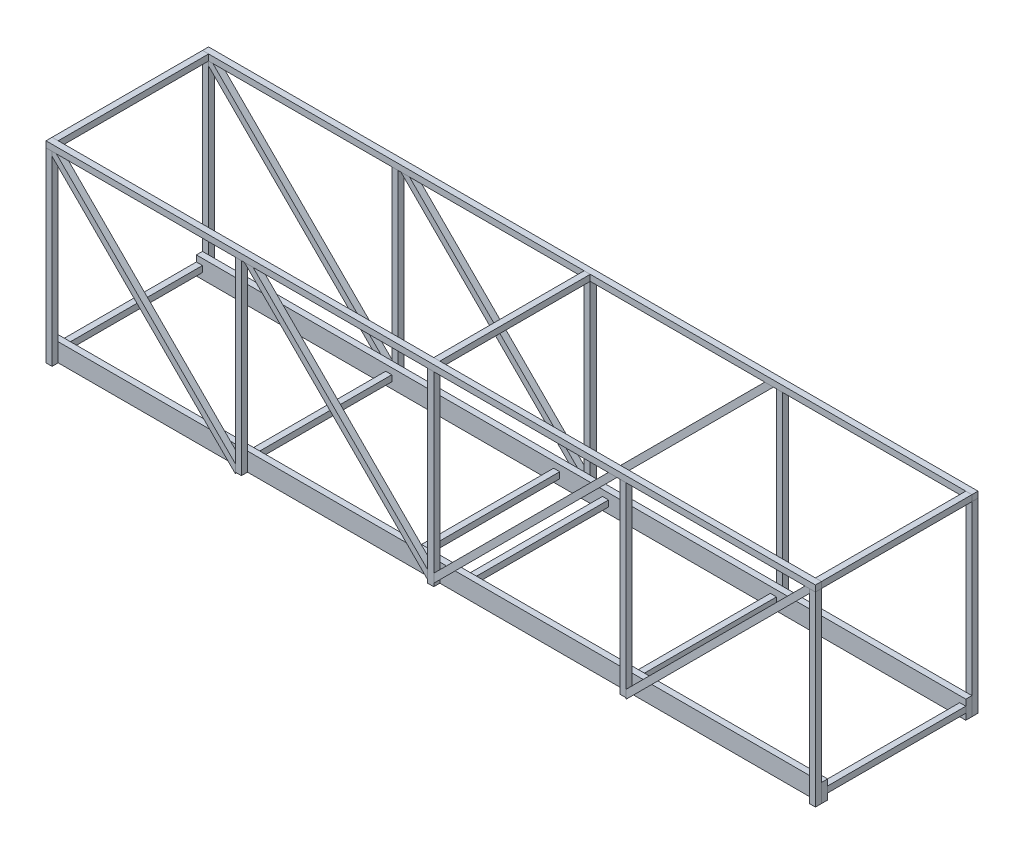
SolidWorks part; units mm, degrees
ref_plane "Front Plane" through (0, 0, 0) normal (0, 0, 1) x (1, 0, 0)
ref_plane "Top Plane" through (0, 0, 0) normal (0, 1, 0) x (1, 0, 0)
ref_plane "Right Plane" through (0, 0, 0) normal (1, 0, 0) x (0, 0, -1)
sketch "Sketch1" plane through (0, 0, 0) normal (0, 1, 0) x (1, 0, 0)
  line L0 (0, 37.5) -> (0, -37.5) construction
  line L1 (-200, -37.5) -> (200, -37.5)
  line L2 (-200, -37.5) -> (-200, 37.5)
  line L3 (-200, 37.5) -> (200, 37.5)
  line L4 (200, -37.5) -> (200, 37.5)
  line L5 (-200, -37.5) -> (200, 37.5) construction
  line L6 (-200, 37.5) -> (200, -37.5) construction
  line L7 (-100, 37.5) -> (-100, -37.5)
  line L8 (-12.7, -37.5) -> (-12.7, 37.5)
  line L9 (12.7, 37.5) -> (12.7, -37.5)
  line L10 (100, 37.5) -> (100, -37.5)
  point P0 (0, 0)
  dimension "D1" = 400
  dimension "D2" = 75
  dimension "D3" = 25.4
  dimension "D4" = 100
  dimension "D5" = 100
other "Structural Member1"
ref_plane "Plane1" through (-200, 0, 37.5) normal (1, 0, 0) x (0, 0, -1)
sketch "Sketch12" plane through (-200, 0, 37.5) normal (1, 0, 0) x (0, 0, -1)
  line L1 (-1.5875, -4.7625) -> (1.5875, -4.7625)
  line L2 (-1.5875, -4.7625) -> (-1.5875, 4.7625)
  line L3 (-1.5875, 4.7625) -> (1.5875, 4.7625)
  line L4 (1.5875, -4.7625) -> (1.5875, 4.7625)
  line L5 (-1.5875, -4.7625) -> (1.5875, 4.7625) construction
  line L6 (-1.5875, 4.7625) -> (1.5875, -4.7625) construction
  point P0 (0, 0)
  point P5 (0, 4.7625)
  point P6 (1.5875, 0)
  point P7 (0, -4.7625)
  point P8 (-1.5875, 0)
  point P9 (0, 0)
  dimension "D1" = 3.175
  dimension "D2" = 9.525
other "Structural Member2"
ref_plane "Plane2" through (200, 0, 37.5) normal (0, 0, -1) x (-1, 0, 0)
sketch "Sketch14" plane through (198.4125, 0, 37.5) normal (0, 0, -1) x (-1, 0, 0)
  line L1 (-1.5875, -1.5875) -> (1.5875, -1.5875)
  line L2 (-1.5875, -1.5875) -> (-1.5875, 1.5875)
  line L3 (-1.5875, 1.5875) -> (1.5875, 1.5875)
  line L4 (1.5875, -1.5875) -> (1.5875, 1.5875)
  line L5 (-1.5875, -1.5875) -> (1.5875, 1.5875) construction
  line L6 (-1.5875, 1.5875) -> (1.5875, -1.5875) construction
  point P0 (0, 0)
  point P5 (-1.5875, 0)
  point P6 (0, 1.5875)
  point P7 (1.5875, 0)
  point P8 (0, -1.5875)
  point P9 (0, 0)
  dimension "D1" = 3.175
other "Structural Member3"
ref_plane "Plane3" through (-200, 0, 37.5) normal (0, 0, -1) x (-1, 0, 0)
sketch "Sketch15" plane through (-198.4125, 0, 37.5) normal (0, 0, -1) x (-1, 0, 0)
  line L1 (-1.5875, -1.5875) -> (1.5875, -1.5875)
  line L2 (-1.5875, -1.5875) -> (-1.5875, 1.5875)
  line L3 (-1.5875, 1.5875) -> (1.5875, 1.5875)
  line L4 (1.5875, -1.5875) -> (1.5875, 1.5875)
  line L5 (-1.5875, -1.5875) -> (1.5875, 1.5875) construction
  line L6 (-1.5875, 1.5875) -> (1.5875, -1.5875) construction
  point P0 (0, 0)
  point P5 (-1.5875, 0)
  point P6 (0, 1.5875)
  point P7 (1.5875, 0)
  point P8 (0, -1.5875)
  point P9 (0, 0)
  dimension "D1" = 3.175
other "Structural Member4"
ref_plane "Plane4" through (-100, 0, -37.5) normal (0, 0, 1) x (1, 0, 0)
sketch "Sketch16" plane through (-100, 0, -37.5) normal (0, 0, 1) x (1, 0, 0)
  line L1 (-1.5875, -1.5875) -> (1.5875, -1.5875)
  line L2 (-1.5875, -1.5875) -> (-1.5875, 1.5875)
  line L3 (-1.5875, 1.5875) -> (1.5875, 1.5875)
  line L4 (1.5875, -1.5875) -> (1.5875, 1.5875)
  line L5 (-1.5875, -1.5875) -> (1.5875, 1.5875) construction
  line L6 (-1.5875, 1.5875) -> (1.5875, -1.5875) construction
  point P0 (0, 0)
  point P5 (-1.5875, 0)
  point P6 (0, 1.5875)
  point P7 (1.5875, 0)
  point P8 (0, -1.5875)
  point P9 (0, 0)
  dimension "D1" = 3.175
other "Trim/Extend1"
sketch "Sketch18" plane through (0, 0, 39.0875) normal (0, 0, 1) x (1, 0, 0)
  line L0 (-200, -4.7625) -> (-200, 95.2375)
  line L1 (-200, 95.2375) -> (200, 95.2375)
  line L2 (200, -4.7625) -> (200, 95.2375)
  line L3 (0, -4.7625) -> (0, 95.2375)
  line L4 (200, -4.7625) -> (-200, -4.7625) construction
  line L5 (-100, 95.2375) -> (-100, -4.7625)
  line L6 (100, 95.2375) -> (100, -4.7625)
  dimension "D1" = 100
  dimension "D2" = 100
  dimension "D3" = 100
other "Structural Member5"
ref_plane "Plane5" through (-200, -4.7625, 39.0875) normal (0, 1, 0) x (-1, 0, 0)
sketch "Sketch17" plane through (-198.4125, -4.7625, 40.675) normal (0, 1, 0) x (-1, 0, 0)
  line L1 (-1.5875, -1.5875) -> (1.5875, -1.5875)
  line L2 (-1.5875, -1.5875) -> (-1.5875, 1.5875)
  line L3 (-1.5875, 1.5875) -> (1.5875, 1.5875)
  line L4 (1.5875, -1.5875) -> (1.5875, 1.5875)
  line L5 (-1.5875, -1.5875) -> (1.5875, 1.5875) construction
  line L6 (-1.5875, 1.5875) -> (1.5875, -1.5875) construction
  point P0 (0, 0)
  point P5 (-1.5875, 0)
  point P6 (0, 1.5875)
  point P7 (1.5875, 0)
  point P8 (0, -1.5875)
  point P9 (0, 0)
  dimension "D1" = 3.175
other "Structural Member6"
ref_plane "Plane6" through (200, -4.7625, 39.0875) normal (0, 1, 0) x (-1, 0, 0)
sketch "Sketch19" plane through (198.4125, -4.7625, 40.675) normal (0, 1, 0) x (-1, 0, 0)
  line L1 (-1.5875, -1.5875) -> (1.5875, -1.5875)
  line L2 (-1.5875, -1.5875) -> (-1.5875, 1.5875)
  line L3 (-1.5875, 1.5875) -> (1.5875, 1.5875)
  line L4 (1.5875, -1.5875) -> (1.5875, 1.5875)
  line L5 (-1.5875, -1.5875) -> (1.5875, 1.5875) construction
  line L6 (-1.5875, 1.5875) -> (1.5875, -1.5875) construction
  point P0 (0, 0)
  point P5 (-1.5875, 0)
  point P6 (0, 1.5875)
  point P7 (1.5875, 0)
  point P8 (0, -1.5875)
  point P9 (0, 0)
  dimension "D1" = 3.175
other "Structural Member7"
ref_plane "Plane7" through (100, 95.2375, 39.0875) normal (0, -1, 0) x (1, 0, 0)
sketch "Sketch110" plane through (100, 95.2375, 40.675) normal (0, -1, 0) x (1, 0, 0)
  line L1 (-1.5875, -1.5875) -> (1.5875, -1.5875)
  line L2 (-1.5875, -1.5875) -> (-1.5875, 1.5875)
  line L3 (-1.5875, 1.5875) -> (1.5875, 1.5875)
  line L4 (1.5875, -1.5875) -> (1.5875, 1.5875)
  line L5 (-1.5875, -1.5875) -> (1.5875, 1.5875) construction
  line L6 (-1.5875, 1.5875) -> (1.5875, -1.5875) construction
  point P0 (0, 0)
  point P5 (-1.5875, 0)
  point P6 (0, 1.5875)
  point P7 (1.5875, 0)
  point P8 (0, -1.5875)
  point P9 (0, 0)
  dimension "D1" = 3.175
other "Structural Member8"
ref_plane "Plane8" through (-200, 95.2375, 39.0875) normal (1, 0, 0) x (0, 1, 0)
sketch "Sketch111" plane through (-200, 93.65, 40.675) normal (1, 0, 0) x (0, 1, 0)
  line L1 (-1.5875, -1.5875) -> (1.5875, -1.5875)
  line L2 (-1.5875, -1.5875) -> (-1.5875, 1.5875)
  line L3 (-1.5875, 1.5875) -> (1.5875, 1.5875)
  line L4 (1.5875, -1.5875) -> (1.5875, 1.5875)
  line L5 (-1.5875, -1.5875) -> (1.5875, 1.5875) construction
  line L6 (-1.5875, 1.5875) -> (1.5875, -1.5875) construction
  point P0 (0, 0)
  point P5 (-1.5875, 0)
  point P6 (0, 1.5875)
  point P7 (1.5875, 0)
  point P8 (0, -1.5875)
  point P9 (0, 0)
  dimension "D1" = 3.175
other "Trim/Extend2"
sketch "Sketch124" plane through (0, 0, -39.0875) normal (0, 0, -1) x (-1, 0, 0)
  line L0 (-200, -4.7625) -> (-200, 95.2375)
  line L1 (200, -4.7625) -> (200, 95.2375)
  line L2 (0, -4.7625) -> (0, 95.2375)
  line L3 (-200, -4.7625) -> (200, -4.7625) construction
  line L4 (-100, -4.7625) -> (-100, 95.2375)
  line L5 (100, -4.7625) -> (100, 95.2375)
  line L6 (200, 95.2375) -> (-200, 95.2375)
  line L7 (200, 95.2375) -> (-200, 95.2375) construction
  line L8 (-100, 95.2375) -> (-100, -4.7625) construction
  line L9 (100, 95.2375) -> (100, -4.7625) construction
other "Structural Member15"
ref_plane "Plane16" through (200, -4.7625, -39.0875) normal (0, 1, 0) x (1, 0, 0)
sketch "Sketch125" plane through (198.4125, -4.7625, -40.675) normal (0, 1, 0) x (1, 0, 0)
  line L1 (-1.5875, -1.5875) -> (1.5875, -1.5875)
  line L2 (-1.5875, -1.5875) -> (-1.5875, 1.5875)
  line L3 (-1.5875, 1.5875) -> (1.5875, 1.5875)
  line L4 (1.5875, -1.5875) -> (1.5875, 1.5875)
  line L5 (-1.5875, -1.5875) -> (1.5875, 1.5875) construction
  line L6 (-1.5875, 1.5875) -> (1.5875, -1.5875) construction
  point P0 (0, 0)
  point P5 (-1.5875, 0)
  point P6 (0, 1.5875)
  point P7 (1.5875, 0)
  point P8 (0, -1.5875)
  point P9 (0, 0)
  dimension "D1" = 3.175
other "Structural Member16"
ref_plane "Plane17" through (-200, -4.7625, -39.0875) normal (0, 1, 0) x (1, 0, 0)
sketch "Sketch126" plane through (-198.4125, -4.7625, -40.675) normal (0, 1, 0) x (1, 0, 0)
  line L1 (-1.5875, -1.5875) -> (1.5875, -1.5875)
  line L2 (-1.5875, -1.5875) -> (-1.5875, 1.5875)
  line L3 (-1.5875, 1.5875) -> (1.5875, 1.5875)
  line L4 (1.5875, -1.5875) -> (1.5875, 1.5875)
  line L5 (-1.5875, -1.5875) -> (1.5875, 1.5875) construction
  line L6 (-1.5875, 1.5875) -> (1.5875, -1.5875) construction
  point P0 (0, 0)
  point P5 (-1.5875, 0)
  point P6 (0, 1.5875)
  point P7 (1.5875, 0)
  point P8 (0, -1.5875)
  point P9 (0, 0)
  dimension "D1" = 3.175
other "Structural Member17"
ref_plane "Plane18" through (100, -4.7625, -39.0875) normal (0, 1, 0) x (1, 0, 0)
sketch "Sketch127" plane through (100, -4.7625, -40.675) normal (0, 1, 0) x (1, 0, 0)
  line L1 (-1.5875, -1.5875) -> (1.5875, -1.5875)
  line L2 (-1.5875, -1.5875) -> (-1.5875, 1.5875)
  line L3 (-1.5875, 1.5875) -> (1.5875, 1.5875)
  line L4 (1.5875, -1.5875) -> (1.5875, 1.5875)
  line L5 (-1.5875, -1.5875) -> (1.5875, 1.5875) construction
  line L6 (-1.5875, 1.5875) -> (1.5875, -1.5875) construction
  point P0 (0, 0)
  point P5 (-1.5875, 0)
  point P6 (0, 1.5875)
  point P7 (1.5875, 0)
  point P8 (0, -1.5875)
  point P9 (0, 0)
  dimension "D1" = 3.175
other "Structural Member18"
ref_plane "Plane19" through (-200, 95.2375, -39.0875) normal (1, 0, 0) x (0, -1, 0)
sketch "Sketch128" plane through (-200, 93.65, -40.675) normal (1, 0, 0) x (0, -1, 0)
  line L1 (-1.5875, -1.5875) -> (1.5875, -1.5875)
  line L2 (-1.5875, -1.5875) -> (-1.5875, 1.5875)
  line L3 (-1.5875, 1.5875) -> (1.5875, 1.5875)
  line L4 (1.5875, -1.5875) -> (1.5875, 1.5875)
  line L5 (-1.5875, -1.5875) -> (1.5875, 1.5875) construction
  line L6 (-1.5875, 1.5875) -> (1.5875, -1.5875) construction
  point P0 (0, 0)
  point P5 (-1.5875, 0)
  point P6 (0, 1.5875)
  point P7 (1.5875, 0)
  point P8 (0, -1.5875)
  point P9 (0, 0)
  dimension "D1" = 3.175
other "Trim/Extend3"
sketch "Sketch112" plane through (0, 0, 39.0875) normal (0, 0, 1) x (1, 0, 0)
  line L0 (0, -4.7625) -> (100, 95.2375)
  line L1 (200, -4.7625) -> (-200, -4.7625) construction
  line L3 (-100, 95.2375) -> (0, -4.7625)
other "Structural Member9"
ref_plane "Plane9" through (0, -4.7625, 39.0875) normal (0.7071, 0.7071, 0) x (-0.7071, 0.7071, 0)
sketch "Sketch113" plane through (-1.1225, -3.64, 40.675) normal (0.7071, 0.7071, 0) x (-0.7071, 0.7071, 0)
  line L1 (-1.5875, -1.5875) -> (1.5875, -1.5875)
  line L2 (-1.5875, -1.5875) -> (-1.5875, 1.5875)
  line L3 (-1.5875, 1.5875) -> (1.5875, 1.5875)
  line L4 (1.5875, -1.5875) -> (1.5875, 1.5875)
  line L5 (-1.5875, -1.5875) -> (1.5875, 1.5875) construction
  line L6 (-1.5875, 1.5875) -> (1.5875, -1.5875) construction
  point P0 (0, 0)
  point P5 (-1.5875, 0)
  point P6 (0, 1.5875)
  point P7 (1.5875, 0)
  point P8 (0, -1.5875)
  point P9 (0, 0)
  dimension "D1" = 3.175
other "Trim/Extend6"
sketch "Sketch129" plane through (0, 0, -39.0875) normal (0, 0, -1) x (-1, 0, 0)
  line L0 (0, -4.7625) -> (100, 95.2375)
  line L1 (0, -4.7625) -> (-100, 95.2375)
other "Structural Member19"
ref_plane "Plane20" through (0, -4.7625, -39.0875) normal (0.7071, 0.7071, 0) x (0.7071, -0.7071, 0)
sketch "Sketch130" plane through (-1.1225, -3.64, -40.675) normal (0.7071, 0.7071, 0) x (0.7071, -0.7071, 0)
  line L1 (-1.5875, -1.5875) -> (1.5875, -1.5875)
  line L2 (-1.5875, -1.5875) -> (-1.5875, 1.5875)
  line L3 (-1.5875, 1.5875) -> (1.5875, 1.5875)
  line L4 (1.5875, -1.5875) -> (1.5875, 1.5875)
  line L5 (-1.5875, -1.5875) -> (1.5875, 1.5875) construction
  line L6 (-1.5875, 1.5875) -> (1.5875, -1.5875) construction
  point P0 (0, 0)
  point P5 (-1.5875, 0)
  point P6 (0, 1.5875)
  point P7 (1.5875, 0)
  point P8 (0, -1.5875)
  point P9 (0, 0)
  dimension "D1" = 3.175
other "Trim/Extend17"
sketch "Sketch115" plane through (0, 0, 39.0875) normal (0, 0, 1) x (1, 0, 0)
  line L0 (100, -4.7625) -> (200, 95.2375)
  line L1 (-200, 95.2375) -> (-100, -4.7625)
other "Structural Member10"
ref_plane "Plane11" through (100, -4.7625, 39.0875) normal (0.7071, 0.7071, 0) x (-0.7071, 0.7071, 0)
sketch "Sketch116" plane through (100, -4.7625, 40.675) normal (0.7071, 0.7071, 0) x (-0.7071, 0.7071, 0)
  line L1 (-1.5875, -1.5875) -> (1.5875, -1.5875)
  line L2 (-1.5875, -1.5875) -> (-1.5875, 1.5875)
  line L3 (-1.5875, 1.5875) -> (1.5875, 1.5875)
  line L4 (1.5875, -1.5875) -> (1.5875, 1.5875)
  line L5 (-1.5875, -1.5875) -> (1.5875, 1.5875) construction
  line L6 (-1.5875, 1.5875) -> (1.5875, -1.5875) construction
  point P0 (0, 0)
  point P5 (-1.5875, 0)
  point P6 (0, 1.5875)
  point P7 (1.5875, 0)
  point P8 (0, -1.5875)
  point P9 (0, 0)
  dimension "D1" = 3.175
other "Trim/Extend8"
other "Structural Member11"
ref_plane "Plane12" through (-200, 95.2375, 39.0875) normal (0.7071, -0.7071, 0) x (0.7071, 0.7071, 0)
sketch "Sketch117" plane through (-200, 95.2375, 40.675) normal (0.7071, -0.7071, 0) x (0.7071, 0.7071, 0)
  line L1 (-1.5875, -1.5875) -> (1.5875, -1.5875)
  line L2 (-1.5875, -1.5875) -> (-1.5875, 1.5875)
  line L3 (-1.5875, 1.5875) -> (1.5875, 1.5875)
  line L4 (1.5875, -1.5875) -> (1.5875, 1.5875)
  line L5 (-1.5875, -1.5875) -> (1.5875, 1.5875) construction
  line L6 (-1.5875, 1.5875) -> (1.5875, -1.5875) construction
  point P0 (0, 0)
  point P5 (-1.5875, 0)
  point P6 (0, 1.5875)
  point P7 (1.5875, 0)
  point P8 (0, -1.5875)
  point P9 (0, 0)
  dimension "D1" = 3.175
other "Trim/Extend16"
other "Trim/Extend15"
sketch "Sketch132" plane through (0, 0, -39.0875) normal (0, 0, -1) x (-1, 0, 0)
  line L0 (-100, -4.7625) -> (-200, 95.2375)
  line L1 (100, -4.7625) -> (200, 95.2375)
other "Structural Member21"
ref_plane "Plane22" through (-100, -4.7625, -39.0875) normal (-0.7071, 0.7071, 0) x (0.7071, 0.7071, 0)
sketch "Sketch133" plane through (-100, -4.7625, -40.675) normal (-0.7071, 0.7071, 0) x (0.7071, 0.7071, 0)
  line L1 (-1.5875, -1.5875) -> (1.5875, -1.5875)
  line L2 (-1.5875, -1.5875) -> (-1.5875, 1.5875)
  line L3 (-1.5875, 1.5875) -> (1.5875, 1.5875)
  line L4 (1.5875, -1.5875) -> (1.5875, 1.5875)
  line L5 (-1.5875, -1.5875) -> (1.5875, 1.5875) construction
  line L6 (-1.5875, 1.5875) -> (1.5875, -1.5875) construction
  point P0 (0, 0)
  point P5 (-1.5875, 0)
  point P6 (0, 1.5875)
  point P7 (1.5875, 0)
  point P8 (0, -1.5875)
  point P9 (0, 0)
  dimension "D1" = 3.175
other "Trim/Extend13"
other "Structural Member22"
ref_plane "Plane23" through (100, -4.7625, -39.0875) normal (0.7071, 0.7071, 0) x (0.7071, -0.7071, 0)
sketch "Sketch134" plane through (100, -4.7625, -40.675) normal (0.7071, 0.7071, 0) x (0.7071, -0.7071, 0)
  line L1 (-1.5875, -1.5875) -> (1.5875, -1.5875)
  line L2 (-1.5875, -1.5875) -> (-1.5875, 1.5875)
  line L3 (-1.5875, 1.5875) -> (1.5875, 1.5875)
  line L4 (1.5875, -1.5875) -> (1.5875, 1.5875)
  line L5 (-1.5875, -1.5875) -> (1.5875, 1.5875) construction
  line L6 (-1.5875, 1.5875) -> (1.5875, -1.5875) construction
  point P0 (0, 0)
  point P5 (-1.5875, 0)
  point P6 (0, 1.5875)
  point P7 (1.5875, 0)
  point P8 (0, -1.5875)
  point P9 (0, 0)
  dimension "D1" = 3.175
other "Trim/Extend14"
sketch "Sketch118" plane through (0, 95.2375, 0) normal (0, 1, 0) x (1, 0, 0)
  line L0 (200, -39.0875) -> (200, 39.0875)
  line L1 (-200, -39.0875) -> (-200, 39.0875)
  line L2 (200, 39.0875) -> (-200, 39.0875) construction
other "Structural Member12"
ref_plane "Plane13" through (200, 95.2375, 39.0875) normal (0, 0, -1) x (-1, 0, 0)
sketch "Sketch119" plane through (198.4125, 93.65, 39.0875) normal (0, 0, -1) x (-1, 0, 0)
  line L1 (-1.5875, -1.5875) -> (1.5875, -1.5875)
  line L2 (-1.5875, -1.5875) -> (-1.5875, 1.5875)
  line L3 (-1.5875, 1.5875) -> (1.5875, 1.5875)
  line L4 (1.5875, -1.5875) -> (1.5875, 1.5875)
  line L5 (-1.5875, -1.5875) -> (1.5875, 1.5875) construction
  line L6 (-1.5875, 1.5875) -> (1.5875, -1.5875) construction
  point P0 (0, 0)
  point P5 (-1.5875, 0)
  point P6 (0, 1.5875)
  point P7 (1.5875, 0)
  point P8 (0, -1.5875)
  point P9 (0, 0)
  dimension "D1" = 3.175
other "Structural Member13"
ref_plane "Plane14" through (-200, 95.2375, 39.0875) normal (0, 0, -1) x (-1, 0, 0)
sketch "Sketch120" plane through (-198.4125, 93.65, 39.0875) normal (0, 0, -1) x (-1, 0, 0)
  line L1 (-1.5875, -1.5875) -> (1.5875, -1.5875)
  line L2 (-1.5875, -1.5875) -> (-1.5875, 1.5875)
  line L3 (-1.5875, 1.5875) -> (1.5875, 1.5875)
  line L4 (1.5875, -1.5875) -> (1.5875, 1.5875)
  line L5 (-1.5875, -1.5875) -> (1.5875, 1.5875) construction
  line L6 (-1.5875, 1.5875) -> (1.5875, -1.5875) construction
  point P0 (0, 0)
  point P5 (-1.5875, 0)
  point P6 (0, 1.5875)
  point P7 (1.5875, 0)
  point P8 (0, -1.5875)
  point P9 (0, 0)
  dimension "D1" = 3.175
sketch "Sketch121" plane through (0, 95.2375, 0) normal (0, 1, 0) x (1, 0, 0)
  line L0 (0, -39.0875) -> (0, 39.0875)
  line L1 (200, -39.0875) -> (-200, -39.0875) construction
  line L3 (-200, 39.0875) -> (200, 39.0875) construction
other "Structural Member14"
ref_plane "Plane15" through (0, 95.2375, 39.0875) normal (0, 0, -1) x (-1, 0, 0)
sketch "Sketch123" plane through (0, 93.65, 39.0875) normal (0, 0, -1) x (-1, 0, 0)
  line L1 (-1.5875, -1.5875) -> (1.5875, -1.5875)
  line L2 (-1.5875, -1.5875) -> (-1.5875, 1.5875)
  line L3 (-1.5875, 1.5875) -> (1.5875, 1.5875)
  line L4 (1.5875, -1.5875) -> (1.5875, 1.5875)
  line L5 (-1.5875, -1.5875) -> (1.5875, 1.5875) construction
  line L6 (-1.5875, 1.5875) -> (1.5875, -1.5875) construction
  point P0 (0, 0)
  point P5 (-1.5875, 0)
  point P6 (0, 1.5875)
  point P7 (1.5875, 0)
  point P8 (0, -1.5875)
  point P9 (0, 0)
  dimension "D1" = 3.175
equation "\"D2@Sketch12\" = \"D1@Sketch12\" * 3"
